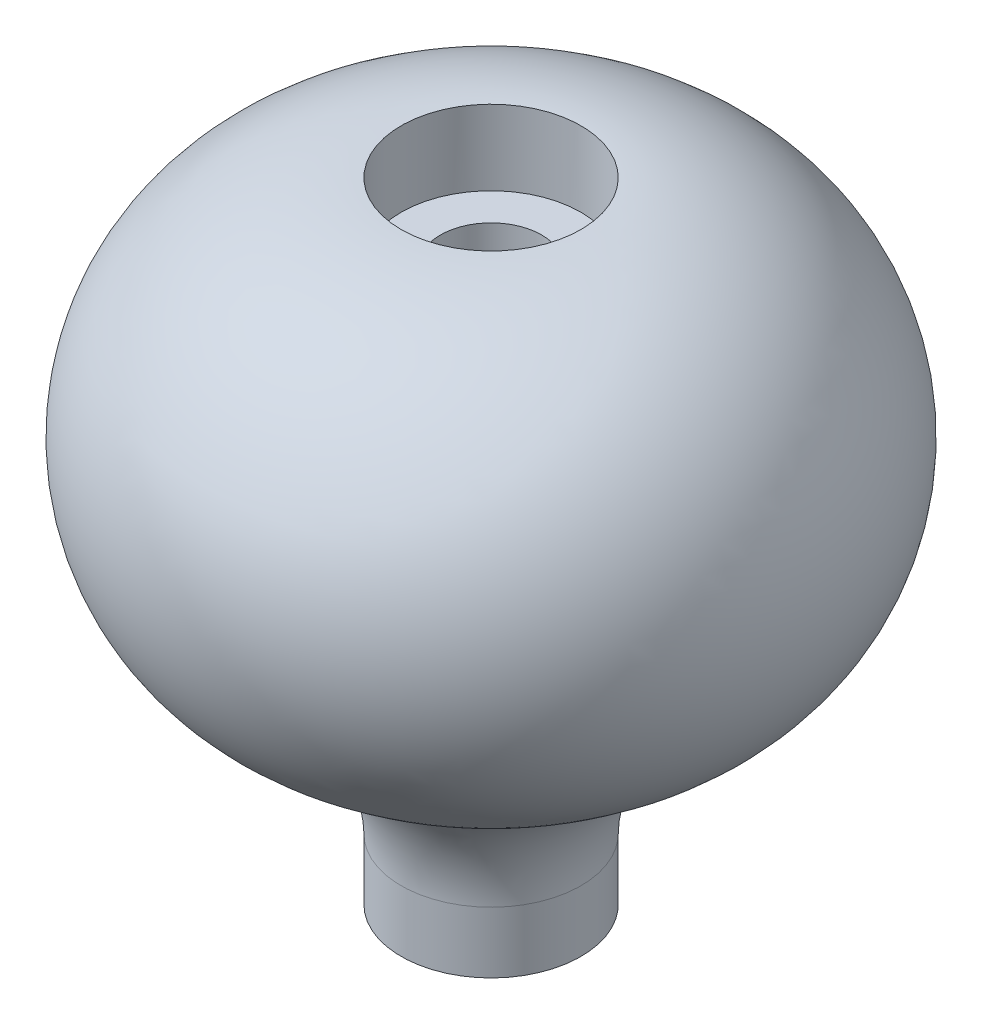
SolidWorks part; units mm, degrees
ref_plane "Front Plane" through (0, 0, 0) normal (0, 0, 1) x (1, 0, 0)
ref_plane "Top Plane" through (0, 0, 0) normal (0, 1, 0) x (1, 0, 0)
ref_plane "Right Plane" through (0, 0, 0) normal (1, 0, 0) x (0, 0, -1)
sketch "Sketch1" plane through (0, 0, 0) normal (0, 0, 1) x (1, 0, 0)
  line L0 (0, 0) -> (6, 0)
  line L1 (6, 0) -> (6, 12)
  line L2 (6, 42) -> (0, 42)
  line L3 (0, 0) -> (0, 42)
  arc A0 (6, 12) -> (6, 42) centre (6, 27) ccw
  dimension "D1" = 15
  dimension "D2" = 6
  dimension "D3" = 12
revolve "Revolve1" add sketch "Sketch1" angle 360 about L3
hole_wizard "1/4 Clearance Hole1" positions "Sketch2" profile "Sketch3" hole size "1/4" standard "ANSI Inch"
sketch "Sketch2" plane through (0, 0, 0) normal (0, -1, 0) x (-1, 0, 0)
  point P0 (0, 0)
sketch "Sketch3" plane through (0, 0, 0) normal (1, 0, 0) x (0, 0, -1)
  line L0 (0, 0) -> (0, 42)
  line L1 (0, 42) -> (3.3782, 42)
  line L2 (3.3782, 42) -> (3.3782, 0)
  line L5 (3.3782, 0) -> (0, 0)
  line L11 (0, -6.35) -> (0, 107.95) construction
  dimension "Thru Hole Dia." = 6.7564
  dimension "Thru Hole Depth" = 42
sketch "Sketch4" plane through (0, 42, 0) normal (0, 1, 0) x (1, 0, 0)
  circle A0 centre (0, 0) radius 6
  dimension "D1" = 12
extrude "Cut-Extrude1" cut sketch "Sketch4" against normal offset from surface (5 mm away) 37
fillet "Fillet1" radius 10 1 edges at (0, 12, -6)
